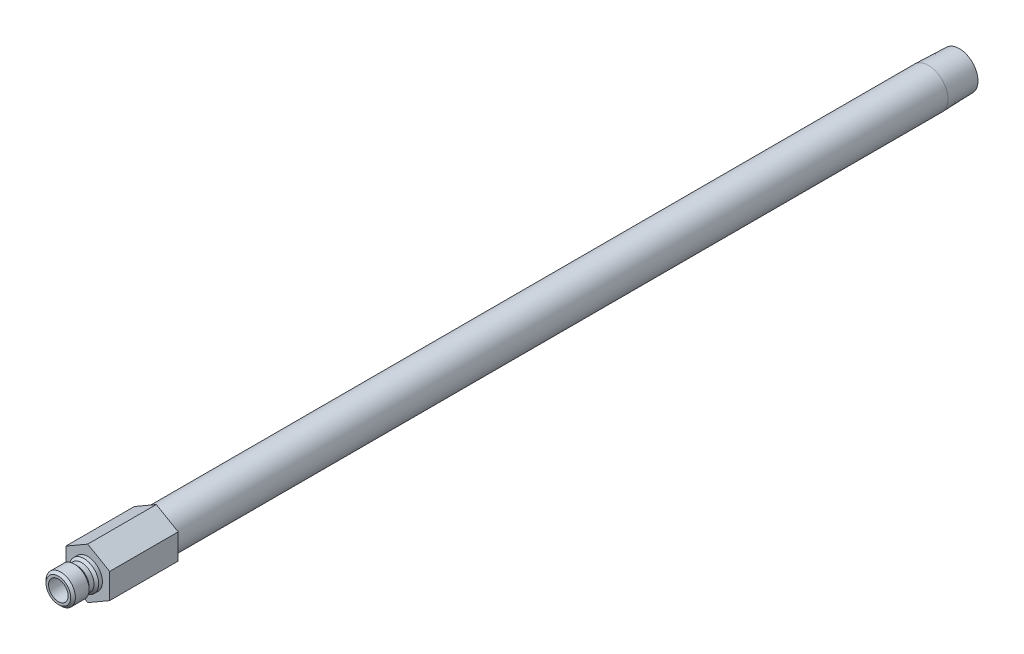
SolidWorks part; units mm, degrees
ref_plane "Front Plane" through (0, 0, 0) normal (0, 0, 1) x (1, 0, 0)
ref_plane "Top Plane" through (0, 0, 0) normal (0, 1, 0) x (1, 0, 0)
ref_plane "Right Plane" through (0, 0, 0) normal (1, 0, 0) x (0, 0, -1)
sketch "Sketch1" plane through (0, 0, 0) normal (1, 0, 0) x (0, 0, -1)
  line L0 (0, 0) -> (-12.7, 0) construction
  line L1 (-9.525, 3.175) -> (-9.525, 4.0005)
  line L2 (-3.556, 4.0005) -> (-3.556, 0) construction
  line L3 (-8.763, 4.7625) -> (-4.318, 4.7625)
  line L4 (0, 6.35) -> (0, 0) construction
  line L5 (-3.556, 4.0005) -> (-1.9685, 4.0005)
  line L6 (-1.2065, 4.7625) -> (0, 4.7625)
  line L7 (0, 4.7625) -> (0, 6.35)
  line L8 (-3.556, 4.0005) -> (-4.318, 4.7625)
  line L9 (-1.9685, 4.0005) -> (-1.2065, 4.7625)
  line L10 (-9.525, 4.0005) -> (-8.763, 4.7625)
  line L11 (22.225, 4.6228) -> (282.575, 4.6228)
  line L12 (0, 6.35) -> (272.542, 6.35)
  line L13 (272.542, 6.35) -> (282.575, 6.0365)
  line L14 (282.575, 6.0365) -> (282.575, 4.6228)
  line L15 (0, 0) -> (22.225, 0) construction
  line L16 (22.225, 0) -> (22.225, 4.7625) construction
  line L17 (22.225, 4.7625) -> (0, 4.7625) construction
  line L18 (22.225, 4.6228) -> (22.225, 3.175)
  line L19 (22.225, 3.175) -> (-9.525, 3.175)
  dimension "D1" = 9.525
  dimension "D2" = 1.5875
  dimension "D3" = 0.762
  dimension "D4" = 45
  dimension "D5" = 5.969
  dimension "D6" = 45
  dimension "D7" = 1.79
  dimension "D8" = 10.033
  dimension "D9" = 292.1
  dimension "D10" = 3.175
  dimension "D11" = 31.75
  dimension "D12" = 9.2456
  dimension "D13" = 6.35
  dimension "D14" = 9.525
  dimension "D15" = 12.7
revolve "Revolve1" add sketch "Sketch1" angle 360 about L0
sketch "Sketch2" plane through (0, 0, 0) normal (0, 0, 1) x (1, 0, 0)
  line L1 (-7.112, 4.1061) -> (-7.112, -4.1061)
  line L2 (-7.112, -4.1061) -> (0, -8.2122)
  line L3 (0, -8.2122) -> (7.112, -4.1061)
  line L4 (7.112, -4.1061) -> (7.112, 4.1061)
  line L5 (7.112, 4.1061) -> (0, 8.2122)
  line L6 (0, 8.2122) -> (-7.112, 4.1061)
  circle A0 centre (0, 0) radius 7.112 construction
  circle A1 centre (0, 0) radius 3.175 construction
  circle A2 centre (0, 0) radius 3.175
  dimension "D1" = 14.224
extrude "Boss-Extrude1" add sketch "Sketch2" against normal up to vertex (22.225 mm away) from vertex at 0
